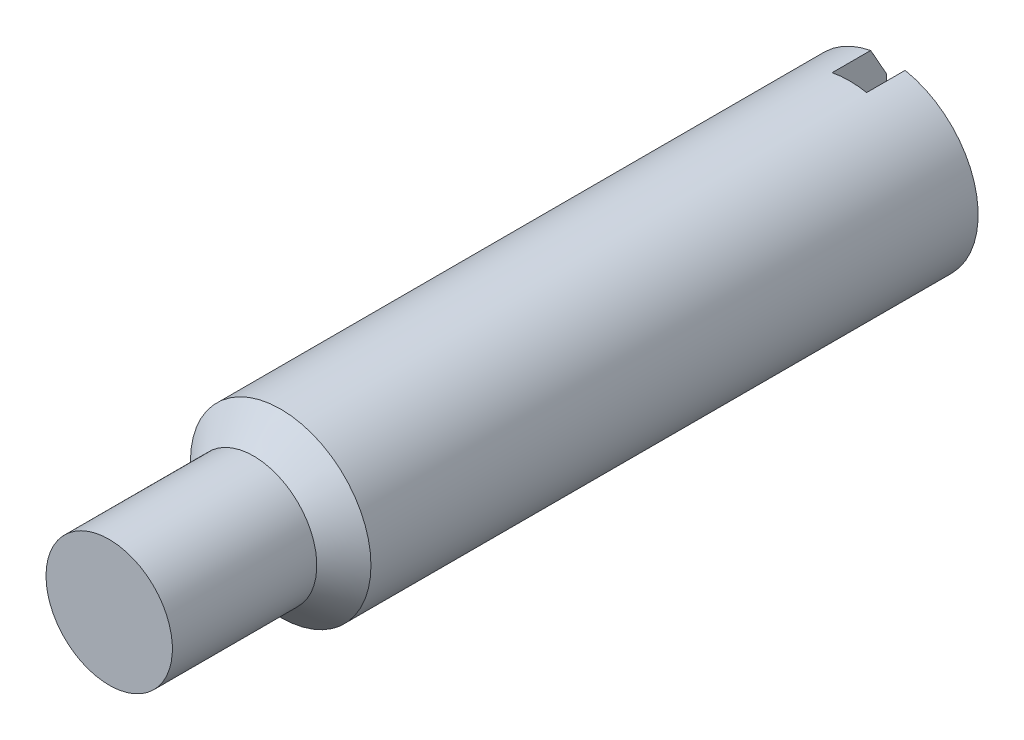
SolidWorks part; units mm, degrees
ref_plane "Plan1" through (0, 0, 0) normal (0, 0, 1) x (1, 0, 0)
ref_plane "Plan2" through (0, 0, 0) normal (0, 1, 0) x (1, 0, 0)
ref_plane "Plan3" through (0, 0, 0) normal (1, 0, 0) x (0, 0, -1)
sketch "E_corps" plane through (0, 0, 0) normal (0, 1, 0) x (1, 0, 0)
  line L0 (0, 0) -> (3.5, 0)
  line L1 (3.5, 0) -> (5, -0.866)
  line L2 (5, -0.866) -> (5, -34.5)
  line L4 (0, -44) -> (0, 0)
  line L6 (0, 10) -> (0, -21.158) construction
  line L7 (3.5, -36) -> (3.5, -44)
  line L8 (3.5, -44) -> (0, -44)
  line L10 (3.5, -36) -> (5, -34.5)
  dimension "D1" = 60
  dimension "D3" = 45
  dimension "Longueur" = 44
  dimension "Diamètre_nominal" = 10
  dimension "Chanfrein" = 1.5
  dimension "Longueur_téton_Max" = 8
  dimension "Diamètre_téton_Max" = 7
revolve "Corps" add sketch "E_corps" angle 360 about L6
sketch "E_fente" plane through (0, 0, 0) normal (0, 1, 0) x (1, 0, 0)
  line L0 (0, 4.3816) -> (0, -2.7428) construction
  line L1 (0.955, 0) -> (-0.955, 0)
  line L2 (-0.955, 0) -> (-0.955, -3)
  line L3 (-0.955, -3) -> (0.955, -3)
  line L4 (0.955, 0) -> (0.955, -3)
  line L5 (-3.5, 0) -> (3.5, 0) construction
  point P8 (0, -3)
  point P9 (0, 0)
  dimension "Largeur" = 1.91
  dimension "Profondeur" = 3
extrude "Fente" cut sketch "E_fente" against normal through all and the other way through all
sketch "Esquisse1" plane through (0, 0, 0) normal (1, 0, 0) x (0, 0, -1)
  point P0 (-44, -3.5)
